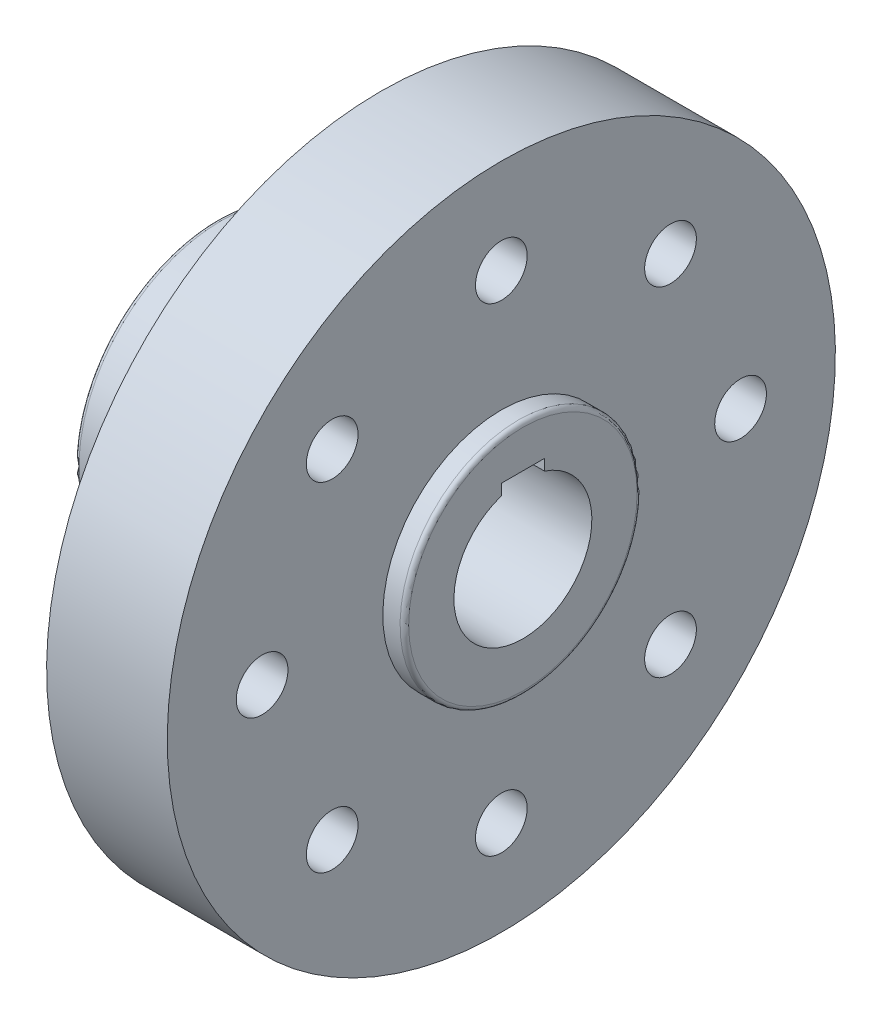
SolidWorks part; units mm, degrees
ref_plane "Front Plane" through (0, 0, 0) normal (0, 0, 1) x (1, 0, 0)
ref_plane "Top Plane" through (0, 0, 0) normal (0, 1, 0) x (1, 0, 0)
ref_plane "Right Plane" through (0, 0, 0) normal (1, 0, 0) x (0, 0, -1)
sketch "Sketch2" plane through (0, 0, 0) normal (0, 0, 1) x (1, 0, 0)
  line L0 (29.1143, 0) -> (-79.6704, 0) construction
  line L1 (29.1143, 0) -> (29.1143, 27.5)
  line L2 (29.1143, 27.5) -> (24.1143, 27.5)
  line L3 (24.1143, 27.5) -> (24.1143, 77.5)
  line L4 (24.1143, 77.5) -> (-3.8857, 77.5)
  line L5 (-3.8857, 77.5) -> (-3.8857, 74.5)
  line L6 (-3.8857, 74.5) -> (10.1143, 74.5)
  line L7 (10.1143, 74.5) -> (10.1143, 33)
  line L8 (10.1143, 33) -> (-41.8857, 33)
  line L9 (-41.8857, 33) -> (-41.8857, 0)
  line L10 (-41.8857, 0) -> (29.1143, 0)
  dimension "D1" = 77.5
  dimension "D2" = 33
  dimension "D3" = 27.5
  dimension "D4" = 28
  dimension "D5" = 5
  dimension "D6" = 14
  dimension "D7" = 38
  dimension "D8" = 71
  dimension "D9" = 3
revolve "Revolve1" add sketch "Sketch2" angle 360 about L0
sketch "Sketch3" plane through (29.1143, 0, 0) normal (1, 0, 0) x (0, 0, -1)
  line L0 (0, 0) -> (0, 81.1281) construction
  line L1 (0, 0) -> (0, -88.3947) construction
  line L3 (-5, 17.75) -> (5, 17.75)
  line L4 (-5, 17.75) -> (-5, 14.25)
  line L5 (-5, 14.25) -> (5, 14.25)
  line L6 (5, 17.75) -> (5, 14.25)
  line L7 (-5, 17.75) -> (5, 14.25) construction
  line L8 (-5, 14.25) -> (5, 17.75) construction
  circle A0 centre (0, 0) radius 16
  point P5 (0, 16)
  dimension "D1" = 32
  dimension "D2" = 17.75
  dimension "D3" = 10
extrude "Cut-Extrude2" cut sketch "Sketch3" against normal through all contours L4 A0 L6 L5
sketch "Sketch4" plane through (24.1143, 0, 0) normal (1, 0, 0) x (0, 0, -1)
  line L0 (0, 77.5) -> (0, -77.5) construction
  circle A0 centre (0, 0) radius 77.5 construction
  circle A1 centre (0, 55.5) radius 6
  circle A2 centre (39.2444, 39.2444) radius 6
  circle A3 centre (55.5, 0) radius 6
  circle A4 centre (39.2444, -39.2444) radius 6
  circle A5 centre (0, -55.5) radius 6
  circle A6 centre (-39.2444, -39.2444) radius 6
  circle A7 centre (-55.5, 0) radius 6
  circle A8 centre (-39.2444, 39.2444) radius 6
  point P24 (0, 0)
  dimension "D1" = 12
  dimension "D2" = 55.5
  dimension "D3" = 8
extrude "Cut-Extrude3" cut sketch "Sketch4" against normal through all
fillet "Fillet1" radius 5 1 edges at (10.1143, 33, 0)
fillet "Fillet2" radius 2 1 edges at (10.1143, 74.5, 0)
fillet "Fillet3" radius 1 3 edges at (-3.8857, 74.5, 0) (29.1143, 27.5, 0) (-41.8857, 33, 0)
chamfer "Chamfer1" distance 2 angle 45 1 edges at (-41.8857, -16, 0)
